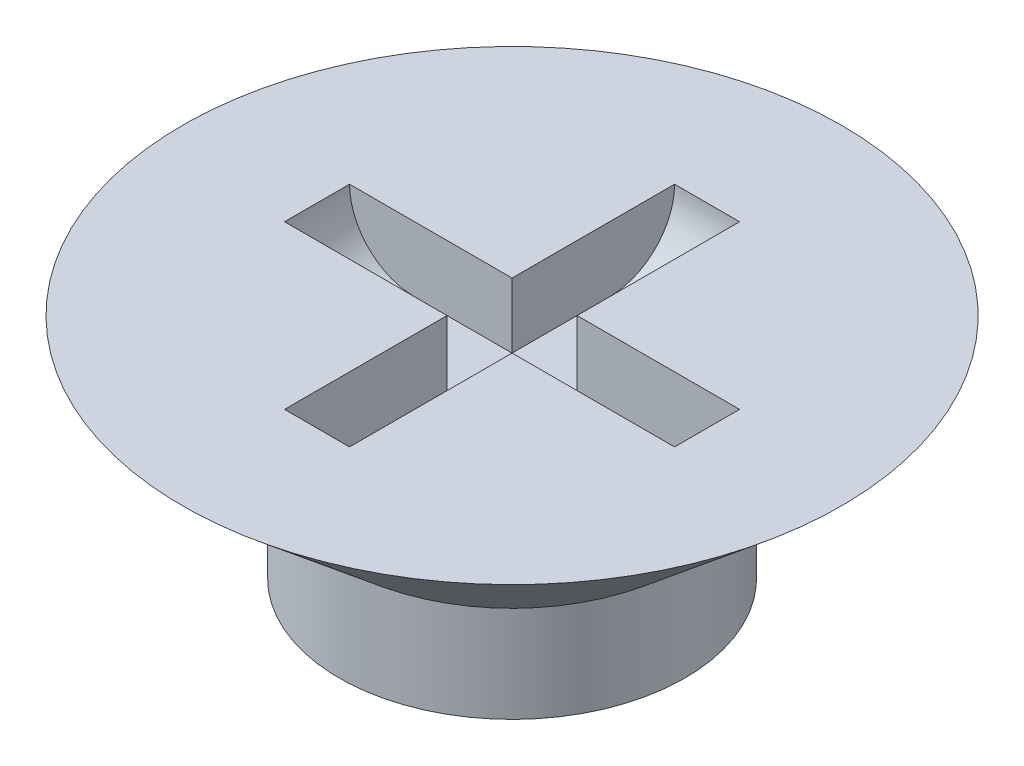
SolidWorks part; units mm, degrees
ref_plane "Front Plane" through (0, 0, 0) normal (0, 0, 1) x (1, 0, 0)
ref_plane "Top Plane" through (0, 0, 0) normal (0, 1, 0) x (1, 0, 0)
ref_plane "Right Plane" through (0, 0, 0) normal (1, 0, 0) x (0, 0, -1)
sketch "Sketch1" plane through (0, 0, 0) normal (1, 0, 0) x (0, 0, -1)
  line L0 (0, 0) -> (0, 4.445)
  line L1 (0, 4.445) -> (6.4389, 4.445)
  line L2 (6.4389, 4.445) -> (3.3782, 1.8796)
  line L3 (3.3782, 1.8796) -> (3.3782, 0)
  line L4 (3.3782, 0) -> (0, 0)
  dimension "D1" = 4.445
  dimension "D2" = 2.5654
  dimension "D3" = 6.4389
  dimension "D4" = 3.3782
revolve "Revolve1" add sketch "Sketch1" angle 360 about L0
sketch "Sketch2" plane through (0, 4.445, 0) normal (0, 1, 0) x (1, 0, 0)
  line L1 (-3.81, -0.635) -> (3.81, -0.635)
  line L2 (-3.81, -0.635) -> (-3.81, 0.635)
  line L3 (-3.81, 0.635) -> (3.81, 0.635)
  line L4 (3.81, -0.635) -> (3.81, 0.635)
  line L5 (-3.81, -0.635) -> (3.81, 0.635) construction
  line L6 (-3.81, 0.635) -> (3.81, -0.635) construction
  line L7 (-0.635, -3.81) -> (0.635, -3.81)
  line L8 (-0.635, -3.81) -> (-0.635, 3.81)
  line L9 (-0.635, 3.81) -> (0.635, 3.81)
  line L10 (0.635, -3.81) -> (0.635, 3.81)
  line L11 (-0.635, -3.81) -> (0.635, 3.81) construction
  line L12 (-0.635, 3.81) -> (0.635, -3.81) construction
  point P0 (0, 0)
  point P6 (0, 0)
  dimension "D1" = 7.62
  dimension "D2" = 1.27
extrude "Cut-Extrude1" cut sketch "Sketch2" against normal blind 1.27 contours L1 L8 L3 L2 | L1 L10 L3 L8 | L7 L10 L1 L8 | L10 L1 L4 L3 | L3 L10 L9 L8
fillet "Fillet1" radius 1.27 4 edges at (-3.81, 3.175, 0) (0, 3.175, -3.81) (3.81, 3.175, 0) (0, 3.175, 3.81)
